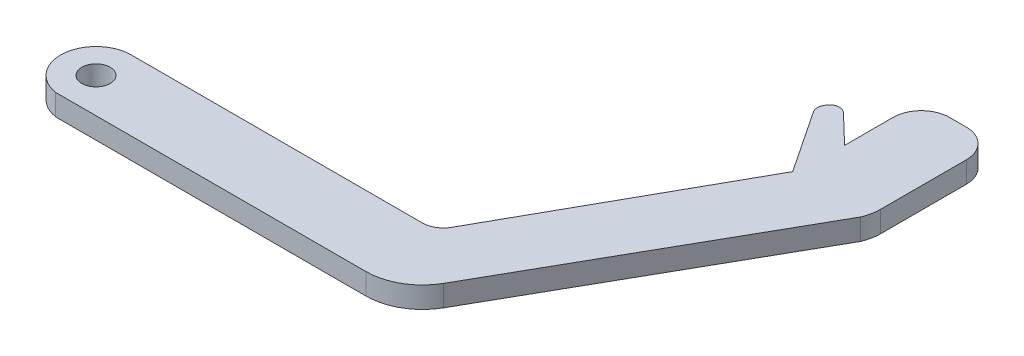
SolidWorks part; units mm, degrees
ref_plane "Front Plane" through (0, 0, 0) normal (0, 0, 1) x (1, 0, 0)
ref_plane "Top Plane" through (0, 0, 0) normal (0, 1, 0) x (1, 0, 0)
ref_plane "Right Plane" through (0, 0, 0) normal (1, 0, 0) x (0, 0, -1)
sketch "Sketch1" plane through (0, 0, 0) normal (0, 1, 0) x (1, 0, 0)
  line L0 (3.899, 5) -> (37.1407, 5)
  line L1 (3.899, -4.9407) -> (39.1018, -4.9407)
  line L2 (57.0519, 37.4739) -> (39.7582, 6.534)
  line L11 (67.4044, 36.7128) -> (46.059, -0.89)
  line L12 (57.0519, 37.4739) -> (51.1901, 46.2734)
  line L13 (51.0906, 47.6502) -> (51.1938, 47.8674)
  line L14 (53.4285, 48.2761) -> (57.508, 44.3553)
  line L15 (57.508, 44.3553) -> (57.508, 48.9302)
  line L16 (57.508, 48.9302) -> (57.508, 51.2044)
  line L17 (3.899, 5) -> (0.899, 5)
  line L18 (3.899, -4.9407) -> (0.899, -4.9407)
  line L19 (0.899, 5) -> (-4, 5)
  line L20 (0.899, -4.9407) -> (-4.7675, -4.9407)
  line L21 (61.508, 55.2044) -> (63.8818, 55.2044)
  line L22 (67.8818, 51.2044) -> (67.8818, 44.3553)
  line L23 (67.8818, 44.3553) -> (67.8818, 39.0581)
  circle A1 centre (-4, 0) radius 2
  arc A6 (39.1018, -4.9407) -> (46.059, -0.89) centre (39.1018, 3.0593) ccw
  arc A7 (37.1407, 5) -> (39.7582, 6.534) centre (37.1407, 8) ccw
  arc A8 (51.1901, 46.2734) -> (51.0906, 47.6502) centre (52.3552, 47.0496) cw
  arc A9 (51.1938, 47.8674) -> (53.4285, 48.2761) centre (52.4584, 47.2668) cw
  arc A10 (63.8818, 55.2044) -> (67.8818, 51.2044) centre (63.8818, 51.2044) cw
  arc A11 (57.508, 51.2044) -> (61.508, 55.2044) centre (61.508, 51.2044) cw
  arc A12 (67.8818, 39.0581) -> (67.4044, 36.7128) centre (61.8818, 39.0581) cw
  arc A14 (-4, 5) -> (-4.7675, -4.9407) centre (-4, 0) ccw
  point P29 (38.899, 5)
  dimension "D2" = 35
  dimension "D8" = 1.4
  dimension "D9" = 4
  dimension "D10" = 6
  dimension "D12" = 4
  dimension "D6" = 8
  dimension "D7" = 3
  dimension "D13" = 4
  dimension "D14" = 3
extrude "Boss-Extrude1" add sketch "Sketch1" along normal blind 3
